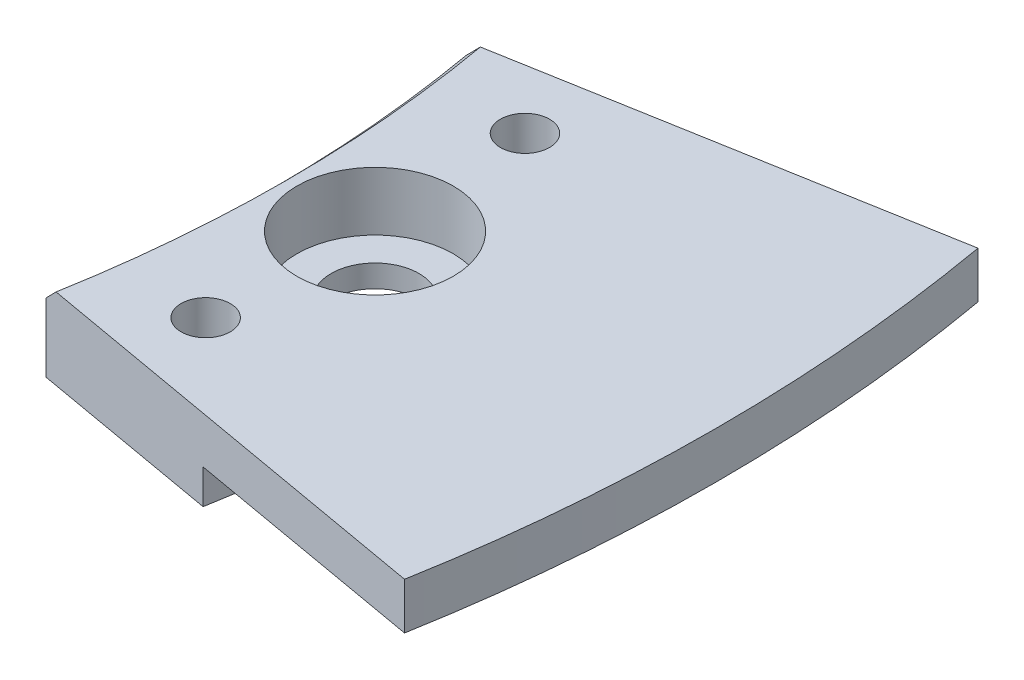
SolidWorks part; units mm, degrees
ref_plane "Front" through (0, 0, 0) normal (0, 0, 1) x (1, 0, 0)
ref_plane "Top" through (0, 0, 0) normal (0, 1, 0) x (1, 0, 0)
ref_plane "Right" through (0, 0, 0) normal (1, 0, 0) x (0, 0, -1)
sketch "Sketch1" plane through (0, 0, 0) normal (0, 0, 1) x (1, 0, 0)
  line L0 (0, 0) -> (0, 45.3887) construction
  line L1 (71.755, 1.762) -> (84.455, 1.762)
  line L2 (61.849, 4.1433) -> (84.455, 4.1433)
  line L3 (61.849, 4.1433) -> (61.849, 0)
  line L4 (61.849, 0) -> (71.755, 0)
  line L5 (71.755, 1.762) -> (71.755, 0)
  line L6 (84.455, 1.762) -> (84.455, 4.1433)
  dimension "D1" = 123.698
  dimension "D2" = 9.906
  dimension "D3" = 2.3813
  dimension "D4" = 1.762
  dimension "D5" = 12.7
revolve "Revolve1" add sketch "Sketch1" angle 10 about L0
hole_wizard "M2.5 Diameter Hole1" positions "Sketch8" profile "Sketch9" hole size "M2.5" standard "Ansi Metric"
sketch "Sketch8" plane through (0, 0, 0) normal (0, -1, 0) x (1, 0, 0)
  line L0 (0, 0) -> (37.2203, 0) construction
  line L1 (0, 0) -> (66.5006, -8.1652) construction
  point P0 (66.5006, -8.1652)
  dimension "D1" = 67
  dimension "D2" = 7
sketch "Sketch9" plane through (66.5006, 0, -8.1652) normal (1, 0, 0) x (0, 0, -1)
  line L0 (0, 0) -> (0, 4.1433)
  line L1 (0, 4.1433) -> (1.2575, 4.1433)
  line L2 (1.2575, 4.1433) -> (1.2575, 0)
  line L5 (1.2575, 0) -> (0, 0)
  line L11 (0, -6.35) -> (0, 107.95) construction
  dimension "Thru Hole Dia." = 2.515
  dimension "Thru Hole Depth" = 4.1433
mirror "Mirror1" about plane through (0, 0, 0) normal (0, 0, 1)
hole_wizard "CBORE for M4 SHCS1" positions "Sketch4" profile "Sketch3" counterbore size "M4" standard "Ansi Metric"
sketch "Sketch4" plane through (0, 4.1433, 0) normal (0, 1, 0) x (-1, 0, 0)
  circle A0 centre (0, 0) radius 67 construction
  point P0 (-67, 0)
sketch "Sketch3" plane through (67, 4.1433, 0) normal (1, 0, 0) x (0, 0, 1)
  line L0 (0, 0) -> (0, 4.1433)
  line L1 (0, 4.1433) -> (2.25, 4.1433)
  line L3 (2.25, 4.1433) -> (2.25, 3)
  line L4 (2.25, 3) -> (4, 3)
  line L5 (4, 3) -> (4, 0)
  line L7 (4, 0) -> (0, 0)
  line L11 (0, -6.35) -> (0, 107.95) construction
  dimension "Thru Hole Dia." = 4.5
  dimension "Thru Hole Depth" = 4.1433
  dimension "C'Bore Dia." = 8
  dimension "C'Bore Depth" = 3
ref_plane "center" through (0, 2.9526, 0) normal (0, 1, 0) x (-1, 0, 0)
chamfer "Chamfer1" [suppressed] distance 4.318 angle 15
chamfer "Chamfer2" [suppressed] distance 4.318 angle 15
chamfer "Chamfer3" distance 0.635 angle 45 1 edges at (61.849, 4.1433, 0)
